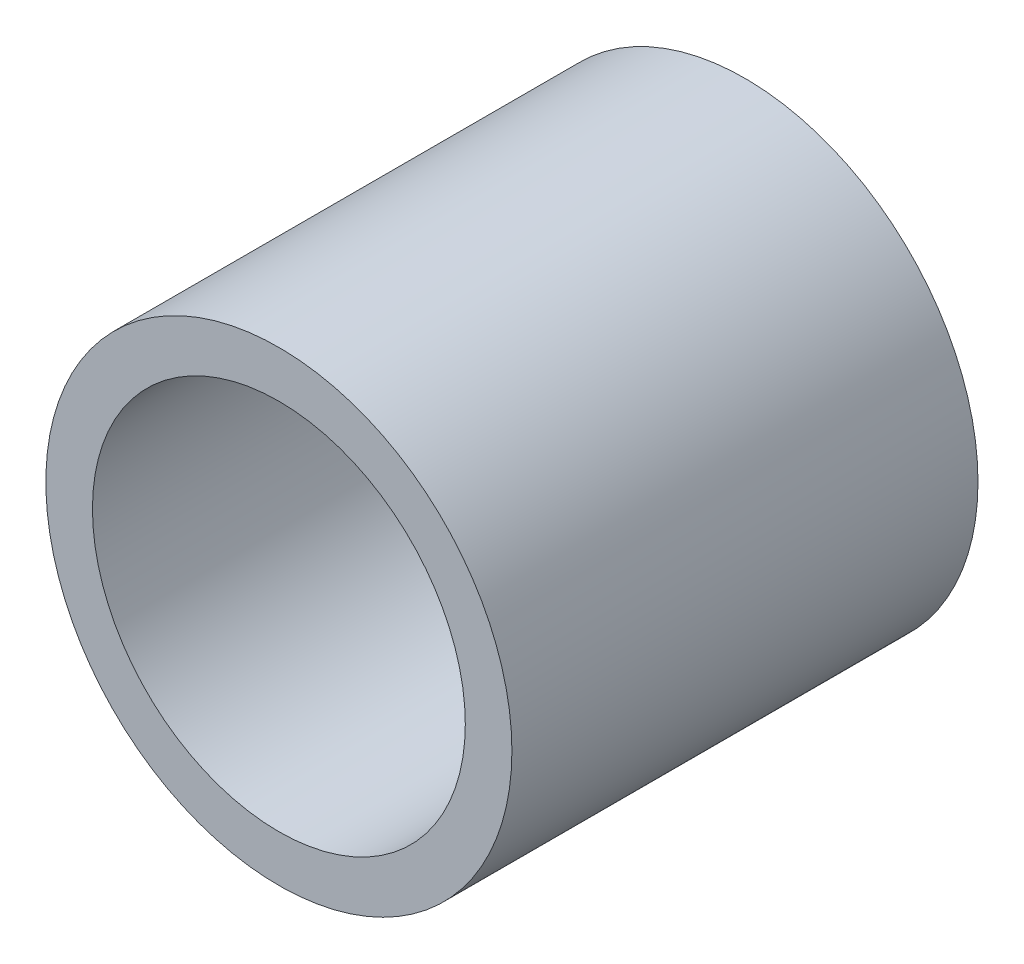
SolidWorks part; units mm, degrees
ref_plane "Front Plane" through (0, 0, 0) normal (0, 0, 1) x (1, 0, 0)
ref_plane "Top Plane" through (0, 0, 0) normal (0, 1, 0) x (1, 0, 0)
ref_plane "Right Plane" through (0, 0, 0) normal (1, 0, 0) x (0, 0, -1)
sketch "Sketch1" plane through (0, 0, 0) normal (0, 0, 1) x (1, 0, 0)
  circle A0 centre (0, 0) radius 12.7
  circle A1 centre (0, 0) radius 10.16
  dimension "D1" = 20.32
  dimension "D2" = 25.4
extrude "Extrude1" add sketch "Sketch1" along normal blind 25.4
